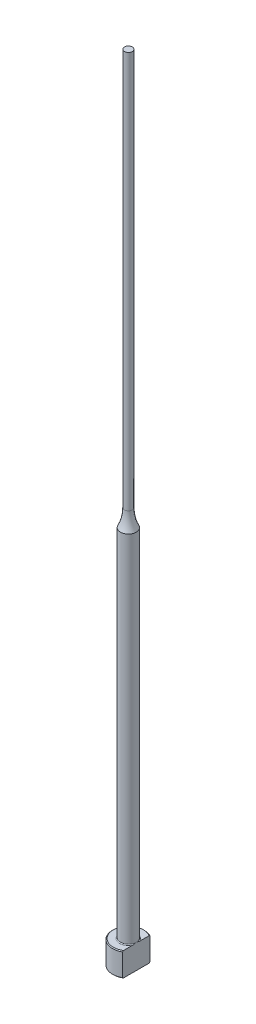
SolidWorks part; units mm, degrees
ref_plane "Front Plane" through (0, 0, 0) normal (0, 0, 1) x (1, 0, 0)
ref_plane "Top Plane" through (0, 0, 0) normal (0, 1, 0) x (1, 0, 0)
ref_plane "Right Plane" through (0, 0, 0) normal (1, 0, 0) x (0, 0, -1)
sketch "Sketch1" plane through (0, 0, 0) normal (0, 0, 1) x (1, 0, 0)
  line L0 (0, 259.9588) -> (0, -15.1925) construction
  line L1 (0, 0) -> (-4, 0)
  line L2 (-4, 0) -> (-4, 6)
  line L3 (-4, 6) -> (-2, 6)
  line L4 (-1, 100) -> (-1, 200)
  line L5 (-1, 200) -> (0, 200)
  line L6 (0, 200) -> (0, 0)
  line L7 (-2, 6) -> (-2, 95.6411)
  arc A0 (-2, 95.6411) -> (-1, 100) centre (-11, 100) ccw
  point P13 (-2, 0)
  dimension "D1" = 10
  dimension "L" = 200
  dimension "H" = 8
  dimension "T" = 6
  dimension "D" = 2
  dimension "B" = 4
  dimension "S" = 100
revolve "Revolve1" add sketch "Sketch1" angle 360 about L0
chamfer "Chamfer1" distance 0.2 angle 45 2 edges at (0, 6, 4) (0, 0, 4)
fillet "Fillet1" radius 0.2 1 edges at (0, 6, 2)
sketch "Sketch2" plane through (0, 0, 0) normal (0, 1, 0) x (1, 0, 0)
  line L0 (2, -3.4641) -> (2, 3.4641)
  circle A0 centre (0, 0) radius 4 construction
  arc A1 (2, -3.4641) -> (2, 3.4641) centre (0, 0) ccw
  circle A2 centre (0, 0) radius 2 construction
extrude "Keyed Head" cut sketch "Sketch2" along normal through all
